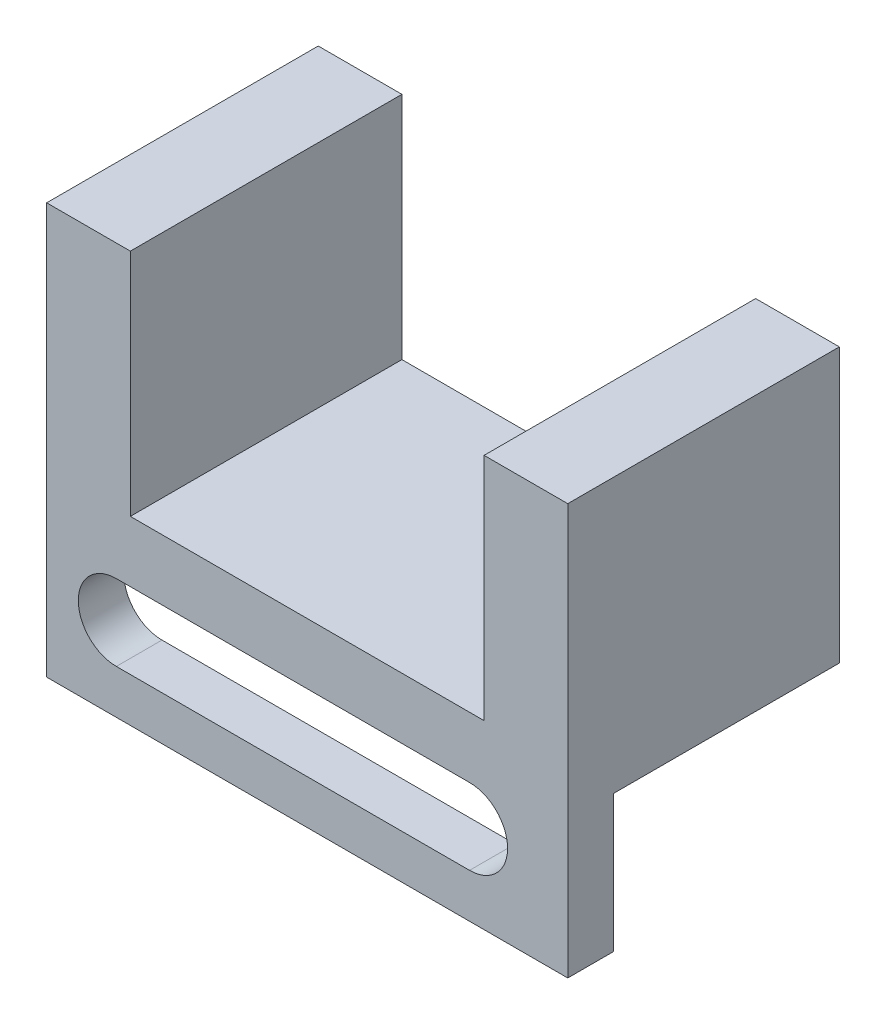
SolidWorks part; units mm, degrees
ref_plane "Front Plane" through (0, 0, 0) normal (0, 0, 1) x (1, 0, 0)
ref_plane "Top Plane" through (0, 0, 0) normal (0, 1, 0) x (1, 0, 0)
ref_plane "Right Plane" through (0, 0, 0) normal (1, 0, 0) x (0, 0, -1)
sketch "Sketch4" plane through (0, 0, -70.6082) normal (0, 0, -1) x (-1, 0, 0)
  line L0 (-46.2169, 93.8) -> (-46.2169, 82.2) construction
  line L1 (-69.0669, 81.5) -> (-45.8169, 81.5)
  line L2 (-69.0669, 81.5) -> (-69.0669, 96.6)
  line L4 (-45.8169, 81.5) -> (-45.8169, 96.6)
  line L5 (-68.6669, 82.2) -> (-68.6669, 93.8) construction
  line L6 (-46.5169, 81.9) -> (-68.3669, 81.9) construction
  line L7 (-45.8169, 96.6) -> (-40.3169, 96.6)
  line L8 (-40.3169, 96.6) -> (-40.3169, 78.6)
  line L9 (-40.3169, 78.6) -> (-74.5669, 78.6)
  line L10 (-74.5669, 78.6) -> (-74.5669, 96.6)
  line L11 (-74.5669, 96.6) -> (-69.0669, 96.6)
  line L12 (-68.3669, 94.1) -> (-46.5169, 94.1) construction
  dimension "D1" = 0.4
  dimension "D2" = 0.4
  dimension "D3" = 0.4
  dimension "D4" = 5.5
  dimension "D5" = 5.5
  dimension "D6" = 18
  dimension "D7" = 2.5
  dimension "D8" = 2.5
extrude "Boss-Extrude1" add sketch "Sketch4" along normal offset from surface (17.85 mm away) 0.4
sketch "Sketch5" plane through (0, 0, -88.4582) normal (0, 0, -1) x (-1, 0, 0)
  circle A0 centre (-43.7419, 88) radius 1
  arc A1 (-43.0041, 88.675) -> (-43.0041, 87.325) centre (-43.7419, 88) ccw construction
  circle A2 centre (-71.1419, 88) radius 1
  arc A3 (-71.8797, 87.325) -> (-71.8797, 88.675) centre (-71.1419, 88) ccw construction
extrude "Cut-Extrude1" cut sketch "Sketch5" against normal blind 10
sketch "Sketch6" plane through (0, 0, -70.6082) normal (0, 0, -1) x (-1, 0, 0)
  line L0 (-68.1119, 75) -> (-44.8968, 75) construction
  line L1 (-74.5669, 78.6) -> (-40.3169, 78.6)
  line L2 (-74.5669, 78.6) -> (-74.5669, 69.6)
  line L3 (-74.5669, 69.6) -> (-40.3169, 69.6)
  line L4 (-40.3169, 78.6) -> (-40.3169, 69.6)
  line L5 (-68.1119, 77.5) -> (-44.8968, 77.5)
  line L6 (-68.1119, 72.5) -> (-44.8968, 72.5)
  arc A4 (-68.1119, 77.5) -> (-68.1119, 72.5) centre (-68.1119, 75) ccw
  arc A5 (-44.8968, 72.5) -> (-44.8968, 77.5) centre (-44.8968, 75) ccw
  point P9 (-68.5112, 70.7128)
  point P10 (-67.1095, 73.0342)
  point P15 (-56.5044, 75)
  dimension "D2" = 2.5
  dimension "D1" = 9
  dimension "D3" = 3.6
  dimension "D4" = 6.455
extrude "Boss-Extrude2" add sketch "Sketch6" along normal blind 3
